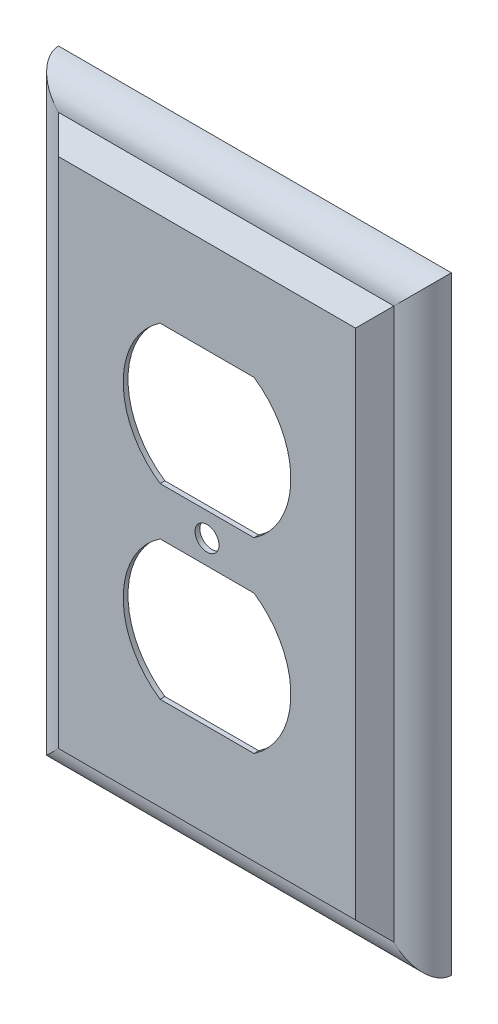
SolidWorks part; units mm, degrees
ref_plane "Plane1" through (0, 0, 0) normal (0, 0, 1) x (1, 0, 0)
ref_plane "Plane2" through (0, 0, 0) normal (0, 1, 0) x (1, 0, 0)
ref_plane "Plane3" through (0, 0, 0) normal (1, 0, 0) x (0, 0, -1)
sketch "Sketch1" plane through (0, 0, 0) normal (0, 0, 1) x (1, 0, 0)
  line L1 (0, 0) -> (70, 0)
  line L2 (0, 0) -> (0, 115)
  line L3 (0, 115) -> (70, 115)
  line L4 (70, 0) -> (70, 115)
  dimension "D1" = 70
  dimension "D2" = 115
extrude "Base-Extrude" add sketch "Sketch1" along normal blind 10
chamfer "Chamfer2" distance 4 angle 45 4 edges at (70, 57.5, 10) (35, 115, 10) (0, 57.5, 10) (35, 0, 10)
shell "Shell1" thickness 1
sketch "Sketch4" plane through (0, 0, 0) normal (0, 0, -1) x (-1, 0, 0)
  line L2 (-4, 57.5) -> (-66, 57.5) construction
  line L3 (-4, 111) -> (-4, 4) construction
  line L4 (-66, 4) -> (-66, 111) construction
  line L5 (-17.5, 77) -> (-52.5, 77) construction
  line L6 (-17.5, 38) -> (-52.5, 38) construction
  line L7 (-25.202, 91.5) -> (-44.798, 91.5)
  line L8 (-25.202, 62.5) -> (-44.798, 62.5)
  line L9 (-25.202, 52.5) -> (-44.798, 52.5)
  line L10 (-25.202, 23.5) -> (-44.798, 23.5)
  arc A0 (-44.798, 91.5) -> (-44.798, 62.5) centre (-35, 77) ccw
  arc A1 (-44.798, 52.5) -> (-44.798, 23.5) centre (-35, 38) ccw
  arc A2 (-25.202, 62.5) -> (-25.202, 91.5) centre (-35, 77) ccw
  arc A3 (-25.202, 23.5) -> (-25.202, 52.5) centre (-35, 38) ccw
  dimension "D1" = 35
  dimension "D2" = 39
  dimension "D3" = 35
  dimension "D4" = 29
extrude "outletcut" cut sketch "Sketch4" against normal through all
sketch "Sketch5" plane through (0, 0, 10) normal (0, 0, 1) x (1, 0, 0)
  line L2 (4, 4) -> (66, 111) construction
  circle A0 centre (35, 57.5) radius 2.5
  dimension "D1" = 5
extrude "screwhole" cut sketch "Sketch5" against normal through all
sketch "Sketch6" plane through (0, 115, 0) normal (0, -1, 0) x (1, 0, 0)
  line L1 (0, 0) -> (70, 0) construction
  line L3 (70, 6) -> (70, 0) construction
  line L5 (70, 6) -> (70, 0)
  line L6 (70, 0) -> (76, 0)
  arc A0 (70, 6) -> (76, 0) centre (70, 0) cw
sketch "Sketch7" plane through (0, 0, 0) normal (0, 0, -1) x (-1, 0, 0)
  line L4 (0, 0) -> (0, 115)
  line L5 (0, 115) -> (-70, 115)
  line L6 (-70, 115) -> (-70, 0)
  line L7 (-70, 0) -> (0, 0)
  line L8 (0, 0) -> (0, 115)
  line L9 (0, 115) -> (-70, 115)
  line L10 (-70, 115) -> (-70, 0)
  line L11 (-70, 0) -> (0, 0)
  dimension "D1" = 0
sweep "Boss-Sweep1" add profiles "Sketch6" path "Sketch7"
